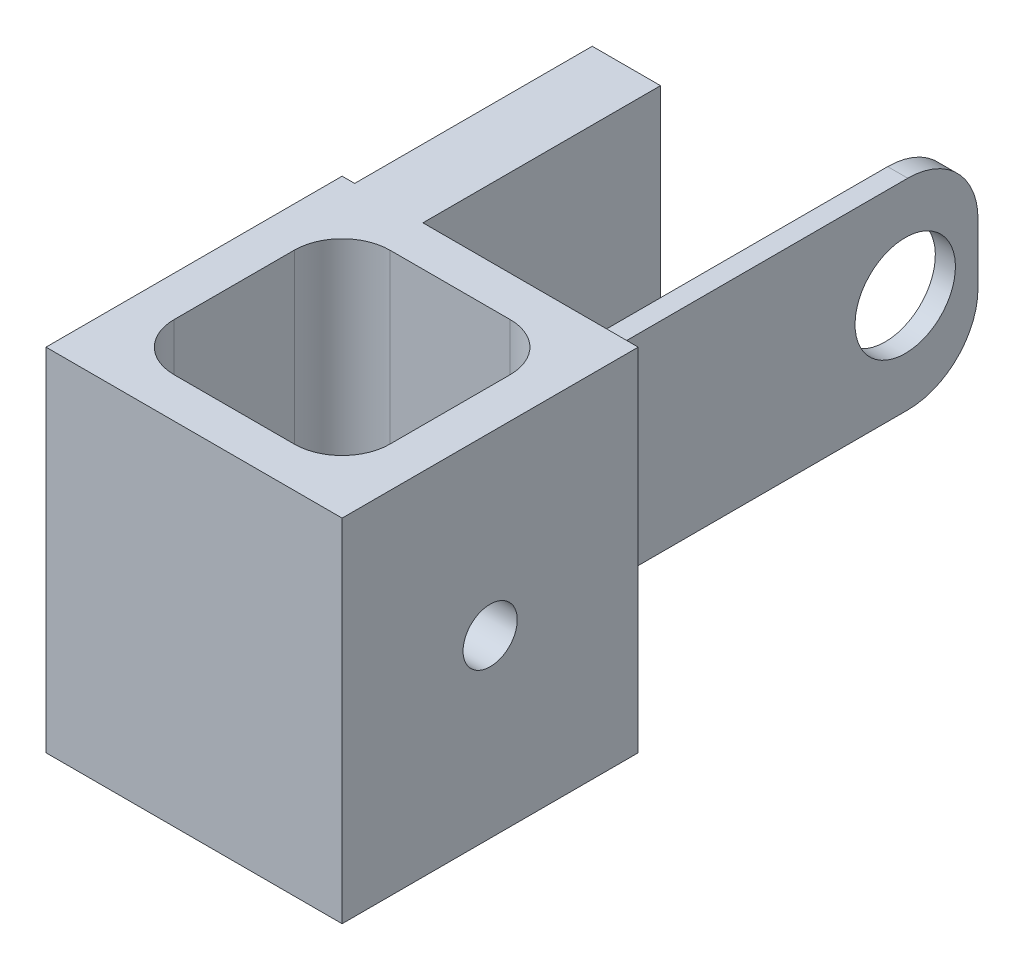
SolidWorks part; units mm, degrees
ref_plane "Front Plane" through (0, 0, 0) normal (0, 0, 1) x (1, 0, 0)
ref_plane "Top Plane" through (0, 0, 0) normal (0, 1, 0) x (1, 0, 0)
ref_plane "Right Plane" through (0, 0, 0) normal (1, 0, 0) x (0, 0, -1)
sketch "Sketch1" plane through (0, 0, 0) normal (0, 1, 0) x (1, 0, 0)
  line L0 (-5.99, 13.75) -> (5.99, 13.75)
  line L1 (-5.99, -10.75) -> (5.99, -10.75)
  line L2 (-10.75, -5.99) -> (-10.75, 5.99)
  line L3 (-5.99, 10.75) -> (5.99, 10.75)
  line L4 (10.75, -5.99) -> (10.75, 5.99)
  line L5 (-10.75, -10.75) -> (10.75, 10.75) construction
  line L6 (-10.75, 10.75) -> (10.75, -10.75) construction
  line L7 (13.75, -5.99) -> (13.75, 5.99)
  line L8 (-5.99, -13.75) -> (5.99, -13.75)
  line L9 (-13.75, -5.99) -> (-13.75, 5.99)
  arc A0 (-5.99, -10.75) -> (-10.75, -5.99) centre (-5.99, -5.99) cw
  arc A1 (5.99, -10.75) -> (10.75, -5.99) centre (5.99, -5.99) ccw
  arc A2 (5.99, 10.75) -> (10.75, 5.99) centre (5.99, 5.99) cw
  arc A3 (-10.75, 5.99) -> (-5.99, 10.75) centre (-5.99, 5.99) cw
  arc A4 (5.99, 13.75) -> (13.75, 5.99) centre (5.99, 5.99) cw
  arc A5 (5.99, -13.75) -> (13.75, -5.99) centre (5.99, -5.99) ccw
  arc A6 (-5.99, -13.75) -> (-13.75, -5.99) centre (-5.99, -5.99) cw
  arc A7 (-13.75, 5.99) -> (-5.99, 13.75) centre (-5.99, 5.99) cw
  point P0 (0, 0)
  dimension "D2" = 4.76
  dimension "D1" = 21.5
  dimension "D3" = 3
extrude "Boss-Extrude1" add sketch "Sketch1" along normal blind 35
sketch "Sketch2" plane through (0, 0, -13.75) normal (0, 0, -1) x (-1, 0, 0)
  line L0 (0, 0) -> (0, 35) construction
  line L1 (-5.99, 0) -> (5.99, 0) construction
  line L2 (-5.99, 35) -> (5.99, 35) construction
  line L3 (0, 17.5) -> (-4.1, 17.5) construction
  line L4 (-4.1, 7.5) -> (-4.1, 27.5)
  line L5 (-4.1, 27.5) -> (-6.1, 27.5)
  line L6 (-6.1, 27.5) -> (-6.1, 7.5)
  line L7 (-4.1, 7.5) -> (-6.1, 7.5)
  point P13 (-6.1, 17.5)
  dimension "D1" = 4.1
  dimension "D2" = 2
  dimension "D3" = 10
extrude "Boss-Extrude2" add sketch "Sketch2" along normal blind 43.5
sketch "Sketch3" plane through (4.1, 0, 0) normal (-1, 0, 0) x (0, 0, 1)
  line L0 (0, 17.5) -> (-50, 17.5) construction
  line L1 (-57.25, 7.5) -> (-57.25, 27.5) construction
  circle A0 centre (-50, 17.5) radius 5
  point P7 (-57.25, 17.5)
  dimension "D2" = 10
  dimension "D1" = 50
extrude "Cut-Extrude1" cut sketch "Sketch3" against normal through all
fillet "Fillet1" radius 7 2 edges at (5.1, 7.5, -57.25) (5.1, 27.5, -57.25)
sketch "Sketch4" plane through (0, 0, -13.75) normal (0, 0, -1) x (-1, 0, 0)
  line L0 (-4.1, 17.5) -> (11.6, 17.5) construction
  line L1 (-4.1, 7.5) -> (-4.1, 27.5) construction
  line L2 (11.6, 4.5) -> (11.6, 30.5) construction
  line L3 (11.6, 30.5) -> (8.6, 30.5) construction
  line L4 (8.6, 30.5) -> (8.6, 4.5) construction
  line L5 (11.6, 4.5) -> (8.6, 4.5) construction
  line L6 (8.6, 17.5) -> (11.6, 17.5) construction
  line L7 (8.6, 0) -> (11.6, 0) construction
  line L8 (5.99, 0) -> (13.75, 0) construction
  line L10 (6.7, 0) -> (13.5, 0)
  line L11 (6.7, 0) -> (6.7, 35)
  line L12 (6.7, 35) -> (13.5, 35)
  line L13 (13.5, 0) -> (13.5, 35)
  line L14 (6.7, 0) -> (13.5, 35) construction
  line L15 (6.7, 35) -> (13.5, 0) construction
  point P9 (8.6, 17.5)
  point P14 (10.1, 0)
  point P15 (10.1, 4.5)
  point P16 (10.1, 0)
  point P19 (10.1, 17.5)
  dimension "D1" = 15.7
  dimension "D2" = 13
  dimension "D3" = 3
  dimension "D4" = 6.8
  dimension "D5" = 35
extrude "Boss-Extrude3" add sketch "Sketch4" along normal blind 24.67 and the other way up to surface separate body
sketch "Sketch12" plane through (0, 0, 13.75) normal (0, 0, 1) x (1, 0, 0)
  line L0 (0, 0) -> (0, 35) construction
  line L1 (-5.99, 35) -> (5.99, 35) construction
  line L2 (0, 17.5) -> (5.99, 17.5) construction
  line L3 (-2.995, 5) -> (2.995, 5) construction
  line L4 (-2.995, 5) -> (-2.995, 30) construction
  line L5 (-2.995, 30) -> (2.995, 30) construction
  line L6 (2.995, 5) -> (2.995, 30) construction
  line L7 (-2.995, 5) -> (2.995, 30) construction
  line L8 (-2.995, 30) -> (2.995, 5) construction
  line L9 (5.99, 35) -> (5.99, 0) construction
  circle A1 centre (-2.995, 30) radius 1.5
  circle A2 centre (2.995, 30) radius 1.5
  circle A3 centre (2.995, 5) radius 1.5
  circle A4 centre (-2.995, 5) radius 1.5
  point P5 (0, 17.5)
  point P14 (2.995, 17.5)
  dimension "D2" = 3
  dimension "D1" = 25
sketch "Sketch13" plane through (0, 0, -38.42) normal (0, 0, -1) x (-1, 0, 0)
  line L0 (10.1, 32) -> (10.1, 3) construction
  line L1 (6.7, 0) -> (13.5, 0) construction
  line L2 (13.5, 35) -> (6.7, 35) construction
  line L3 (6.7, 0) -> (13.5, 0) construction
  point P6 (10.1, 0)
  dimension "D1" = 3
  dimension "D2" = 3
hole_wizard "#4-40 Tapped Hole1" positions "Sketch14" profile "Sketch15" tap size "#4-40" standard "ANSI Inch"
sketch "Sketch14" plane through (0, 0, -38.42) normal (0, 0, -1) x (-1, 0, 0)
  point P0 (10.1, 32)
  point P3 (10.1, 3)
sketch "Sketch15" plane through (-10.1, 32, -38.42) normal (1, 0, 0) x (0, 1, 0)
  line L0 (0, 0) -> (0, 20.6792)
  line L1 (0, 20.6792) -> (1.1303, 20)
  line L2 (1.1303, 20) -> (1.1303, 0)
  line L5 (1.1303, 0) -> (0, 0)
  line L10 (0, 20.6792) -> (-1.1303, 20) construction
  line L11 (0, -6.35) -> (0, 107.95) construction
  dimension "Tap Drill Dia." = 2.2606
  dimension "Tap Drill Depth" = 20
  dimension "Drill Angle" = 118
sketch "Sketch16" plane through (0, 0, -38.42) normal (0, 0, -1) x (-1, 0, 0)
  line L0 (13.5, 0) -> (13.5, 35) construction
  line L1 (13.5, 29) -> (10.5, 29)
  line L2 (13.5, 29) -> (13.5, 6)
  line L3 (13.5, 6) -> (10.5, 6)
  line L4 (10.5, 29) -> (10.5, 6)
  line L5 (6.7, 35) -> (13.5, 0) construction
  point P10 (10.1, 17.5)
  point P11 (10.5, 17.5)
  dimension "D1" = 23
  dimension "D2" = 3
sketch "Sketch17" plane through (13.75, 0, 0) normal (1, 0, 0) x (0, 0, -1)
  line L0 (5.99, 35) -> (5.99, 0) construction
  circle A0 centre (0, 17.5) radius 2.7
  point P6 (5.99, 17.5)
  dimension "D1" = 5.4
extrude "Cut-Extrude3" cut sketch "Sketch17" against normal through all
sketch "Sketch18" plane through (0, 35, 0) normal (0, 1, 0) x (1, 0, 0)
  line L0 (-13.75, 5.99) -> (-13.75, -5.99) construction
  line L1 (-5.99, -13.75) -> (5.99, -13.75) construction
  line L2 (5.99, 13.75) -> (13.75, 13.75)
  line L3 (13.75, 13.75) -> (13.75, 5.99)
  line L4 (-13.75, 5.99) -> (-13.75, 13.75)
  line L5 (-13.75, 13.75) -> (-5.99, 13.75)
  line L6 (-13.75, -5.99) -> (-13.75, -13.75)
  line L7 (-13.75, -13.75) -> (-5.99, -13.75)
  line L8 (5.99, -13.75) -> (13.75, -13.75)
  line L9 (13.75, -13.75) -> (13.75, -5.99)
  line L11 (-14.75, -14.75) -> (14.75, -14.75)
  line L12 (-14.75, -14.75) -> (-14.75, 14.75)
  line L13 (-14.75, 14.75) -> (14.75, 14.75)
  line L14 (14.75, -14.75) -> (14.75, 14.75)
  line L15 (-14.75, -14.75) -> (14.75, 14.75) construction
  line L16 (-14.75, 14.75) -> (14.75, -14.75) construction
  line L18 (-13.75, -13.75) -> (13.75, -13.75)
  line L19 (-13.75, -13.75) -> (-13.75, 13.75)
  line L20 (-13.75, 13.75) -> (13.75, 13.75)
  line L21 (13.75, -13.75) -> (13.75, 13.75)
  line L22 (-13.75, -13.75) -> (13.75, 13.75) construction
  line L23 (-13.75, 13.75) -> (13.75, -13.75) construction
  arc A1 (-5.99, 13.75) -> (-13.75, 5.99) centre (-5.99, 5.99) ccw
  arc A2 (-13.75, -5.99) -> (-5.99, -13.75) centre (-5.99, -5.99) ccw
  arc A3 (5.99, -13.75) -> (13.75, -5.99) centre (5.99, -5.99) ccw
  arc A4 (5.99, -13.75) -> (13.75, -5.99) centre (5.99, -5.99) ccw construction
  arc A5 (5.99, 13.75) -> (13.75, 5.99) centre (5.99, 5.99) cw
  arc A6 (13.75, 5.99) -> (5.99, 13.75) centre (5.99, 5.99) ccw construction
  point P34 (0, 0)
  point P43 (0, 0)
  dimension "D1" = 1
  dimension "D2" = 1
extrude "Boss-Extrude6" add sketch "Sketch18" against normal up to surface (35 mm away) contours L11 L14 L13 L12 L9 L8 L7 L6 L4 L5 L2 L3 M5 M3 M9 M7 | L5 L4 M2 | L3 L2 M8 | L8 L9 M6 | L6 L7 M4
sketch "Sketch19" plane through (10.75, 0, 0) normal (-1, 0, 0) x (0, 0, 1)
  circle A0 centre (0, 17.5) radius 2.7
  dimension "D1" = 5.4
extrude "Cut-Extrude4" cut sketch "Sketch19" against normal through all both and the other way through all
